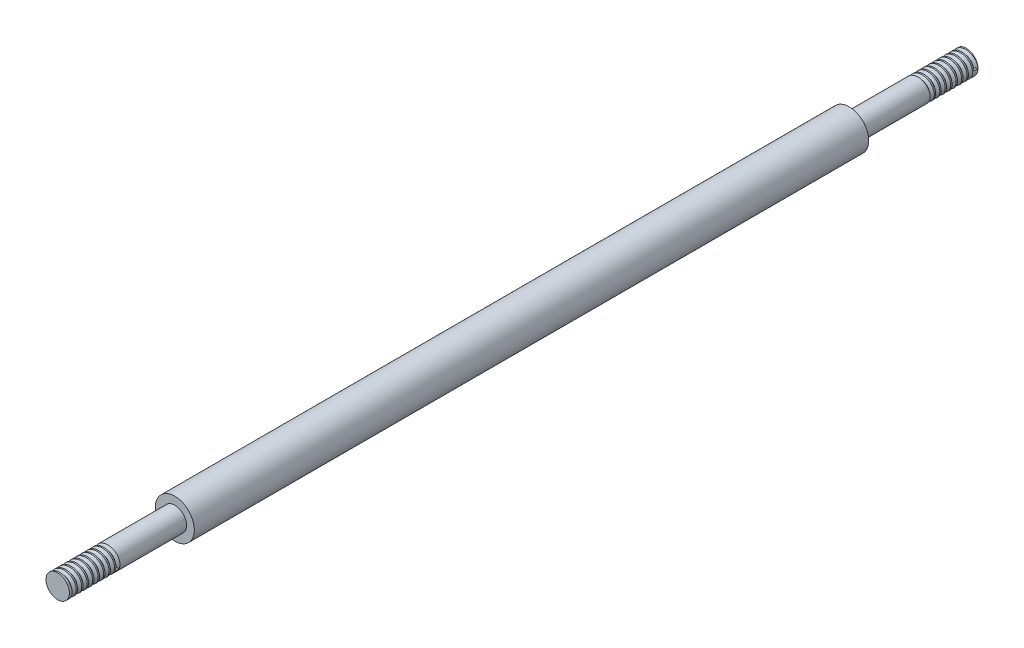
SolidWorks part; units mm, degrees
ref_plane "Front Plane" through (0, 0, 0) normal (0, 0, 1) x (1, 0, 0)
ref_plane "Top Plane" through (0, 0, 0) normal (0, 1, 0) x (1, 0, 0)
ref_plane "Right Plane" through (0, 0, 0) normal (1, 0, 0) x (0, 0, -1)
sketch "Sketch1" plane through (0, 0, 0) normal (0, 0, 1) x (1, 0, 0)
  circle A0 centre (0, 0) radius 1.25
  dimension "D1" = 2.5
extrude "Boss-Extrude1" add sketch "Sketch1" along normal blind 43.2
sketch "Sketch2" plane through (0, 0, 43.2) normal (0, 0, 1) x (1, 0, 0)
  circle A0 centre (0, 0) radius 0.75
  dimension "D1" = 1.5
extrude "Boss-Extrude2" add sketch "Sketch2" along normal blind 7.5
thread "Thread1" pitch 0.35 start angle 0, offset 0, length 3, pitch 0.35, diameter 1.5
ref_plane "Plane1" through (-0.75, 0, 50.7) normal (0, -1, 0) x (-1, 0, 0)
sketch "Thread Profile1" plane through (-0.75, 0, 50.7) normal (0, -1, 0) x (-1, 0, 0)
  line L0 (0, 0) -> (0, 0.35) construction
  line L1 (0, 0.2625) -> (-0.1894, 0.1531)
  line L2 (-0.1894, 0.1531) -> (-0.1894, 0.1094)
  line L3 (-0.1894, 0.1094) -> (0, 0)
  line L4 (-0.1894, 0.1313) -> (0, 0.1313) construction
  line L11 (0, 0.2625) -> (0, 0)
  point P6 (0, 0)
  dimension "Pitch" = 0.35
  dimension "Profile_Angle" = 60
  dimension "Profile_Land" = 0.0437
  dimension "Profile_Height" = 0.1894
ref_plane "Plane2" through (0, 0, 21.6) normal (0, 0, -1) x (-1, 0, 0)
sketch "Sketch6" plane through (0, 0, 0) normal (0, 0, -1) x (-1, 0, 0)
  circle A0 centre (0, 0) radius 0.75
  dimension "D1" = 1.5
extrude "Boss-Extrude3" add sketch "Sketch6" along normal blind 7.5
thread "Thread2" pitch 0.35 start angle 0, offset 0, length 3, pitch 0.35, diameter 1.5
ref_plane "Plane3" through (0.75, 0, -7.5) normal (0, -1, 0) x (1, 0, 0)
sketch "Thread Profile2" plane through (0.75, 0, -7.5) normal (0, -1, 0) x (1, 0, 0)
  line L0 (0, 0) -> (0, 0.35) construction
  line L1 (0, 0.2625) -> (-0.1894, 0.1531)
  line L2 (-0.1894, 0.1531) -> (-0.1894, 0.1094)
  line L3 (-0.1894, 0.1094) -> (0, 0)
  line L4 (-0.1894, 0.1313) -> (0, 0.1313) construction
  line L11 (0, 0.2625) -> (0, 0)
  point P6 (0, 0)
  dimension "Pitch" = 0.35
  dimension "Profile_Angle" = 60
  dimension "Profile_Land" = 0.0437
  dimension "Profile_Height" = 0.1894
scale "Scale1" scale about centroid uniform scaling yes scale factor 0.95
scale "Scale2" scale about centroid uniform scaling yes scale factor 1.052632
scale "Scale3" scale about centroid uniform scaling yes scale factor 0.94
